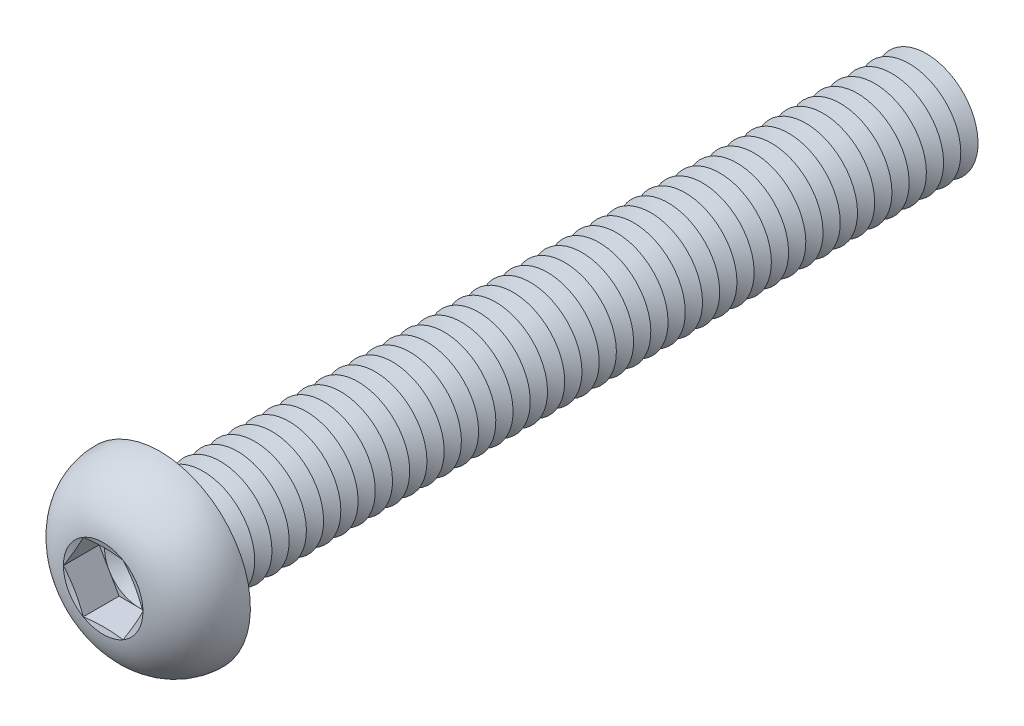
SolidWorks part; units mm, degrees
ref_plane "Front Plane" through (0, 0, 0) normal (0, 0, 1) x (1, 0, 0)
ref_plane "Top Plane" through (0, 0, 0) normal (0, 1, 0) x (1, 0, 0)
ref_plane "Right Plane" through (0, 0, 0) normal (1, 0, 0) x (0, 0, -1)
sketch "Sketch1" plane through (0, 0, 0) normal (1, 0, 0) x (0, 0, -1)
  line L0 (0, 3) -> (0, 5.25)
  line L3 (0, 3) -> (45, 3)
  line L4 (45, 3) -> (45, 0)
  line L5 (45, 0) -> (-3.3, 0) construction
  line L6 (-3.3, 0) -> (45, 0)
  line L7 (-3.3, 2.3094) -> (-3.3, 1.1547) construction
  line L8 (-3.3, 1.1547) -> (-3.3, 0)
  line L9 (-3.3, 2.3094) -> (-2.9906, 1.1547)
  line L10 (-2.9906, 1.1547) -> (-3.3, 1.1547)
  line L11 (45, 0) -> (22.7481, 0) construction
  line L12 (0, 5.25) -> (-3.3, 5.25) construction
  arc A1 (0, 5.25) -> (-3.3, 2.3094) centre (0, 1.928) ccw
  point P8 (45, 1.5)
  dimension "D1" = 10.5
  dimension "D2" = 6
  dimension "D3" = 3.3
  dimension "D4" = 4.6188
  dimension "D5" = 45
  dimension "D6" = 15
revolve "Revolve1" add sketch "Sketch1" angle 360 about L5
fillet "Fillet1" radius 0.5 1 edges at (0, 3, 0)
sketch "Sketch2" plane through (0, 0, 0) normal (1, 0, 0) x (0, 0, -1)
  line L0 (44.5, 3) -> (45.5, 3)
  line L1 (45, 3) -> (0.5, 3) construction
  line L2 (45.5, 3) -> (45, 2.134)
  line L3 (45, -3) -> (45, 3) construction
  line L4 (45, 2.134) -> (44.5, 3)
  dimension "D1" = 1
revolve "Cut-Revolve1" cut sketch "Sketch2" angle 360 about axis through (0, 0, -45) along (0, 0, -1)
pattern_linear "LPattern1" count 45 spacing 1 along (0, 0, 1) of "Cut-Revolve1"
sketch "Sketch3" plane through (0, 0, 3.3) normal (0, 0, 1) x (1, 0, 0)
  line L7 (1.1547, 2) -> (-1.1547, 2)
  line L8 (-1.1547, 2) -> (-2.3094, 0)
  line L9 (-2.3094, 0) -> (-1.1547, -2)
  line L10 (-1.1547, -2) -> (1.1547, -2)
  line L11 (1.1547, -2) -> (2.3094, 0)
  line L12 (2.3094, 0) -> (1.1547, 2)
  circle A0 centre (0, 0) radius 2 construction
  circle A3 centre (0, 0) radius 2.3094 construction
extrude "Cut-Extrude1" cut sketch "Sketch3" against normal blind 2.08
sketch "Sketch4" plane through (0, 0, 1.22) normal (0, 0, 1) x (1, 0, 0)
  line L1 (1.1547, 2) -> (-1.1547, 2) construction
  circle A0 centre (0, 0) radius 2
extrude "Cut-Extrude2" cut sketch "Sketch4" against normal through all draft 60
